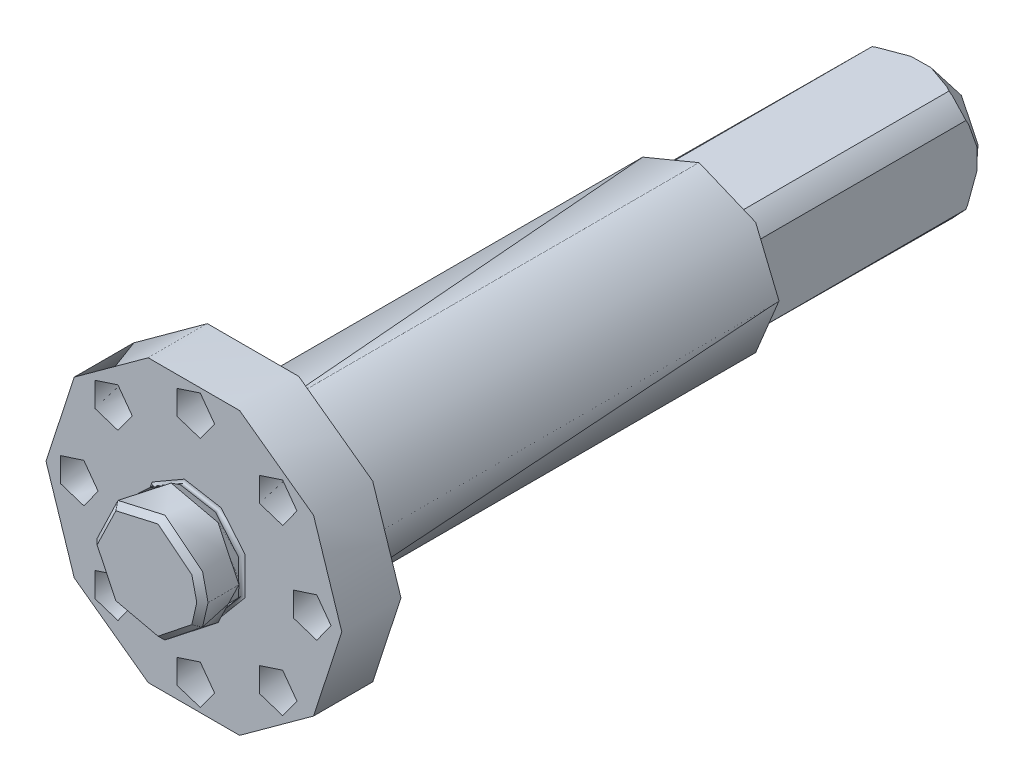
SolidWorks part; units mm, degrees
ref_plane "Front Plane" through (0, 0, 0) normal (0, 0, 1) x (1, 0, 0)
ref_plane "Top Plane" through (0, 0, 0) normal (0, 1, 0) x (1, 0, 0)
ref_plane "Right Plane" through (0, 0, 0) normal (1, 0, 0) x (0, 0, -1)
sketch "Sketch1" plane through (0, 0, 0) normal (1, 0, 0) x (0, 0, -1)
  line L0 (0, 0) -> (-51.9512, 0) construction
  line L1 (0, 0) -> (0, 7.5)
  line L2 (0, 7.5) -> (4.9394, 7.5)
  line L3 (6.35, 7.373) -> (6.35, 20)
  line L4 (6.35, 20) -> (14.35, 20)
  line L5 (14.35, 20) -> (14.35, 10.795)
  line L6 (4.9394, 7.5) -> (5.7547, 7.0293)
  line L7 (14.35, 10.795) -> (74.675, 10.795)
  line L11 (106.425, 9.1281) -> (106.425, 0)
  line L12 (106.425, 0) -> (0, 0)
  line L13 (74.675, 9.1281) -> (106.425, 9.1281)
  line L15 (74.675, 10.795) -> (74.675, 9.1281)
  arc A0 (6.35, 7.373) -> (5.7547, 7.0293) centre (5.9531, 7.373) cw
  dimension "D10" = 0.3969
  dimension "D1" = 18.2562
  dimension "D4" = 60.325
  dimension "D5" = 40
  dimension "D6" = 15
  dimension "D7" = 6.35
  dimension "D8" = 8
  dimension "D11" = 60
  dimension "D12" = 0.127
  dimension "D13" = 21.59
  dimension "D14" = 31.75
revolve "Revolve1" add sketch "Sketch1" angle 360 about L0
hole_wizard "M5 Clearance Hole1" positions "Sketch3" profile "Sketch2" hole size "M5" standard "ANSI Metric"
sketch "Sketch3" plane through (0, 0, -6.35) normal (0, 0, 1) x (1, 0, 0)
  circle A0 centre (0, 0) radius 15.75 construction
  point P0 (-15.75, 0)
  dimension "D1" = 31.5
sketch "Sketch2" plane through (-15.75, 0, -6.35) normal (1, 0, 0) x (0, -1, 0)
  line L0 (0, 0) -> (0, 8.001)
  line L1 (0, 8.001) -> (2.8, 8.001)
  line L2 (2.8, 8.001) -> (2.8, 0)
  line L5 (2.8, 0) -> (0, 0)
  line L11 (0, -6.35) -> (0, 107.95) construction
  dimension "Thru Hole Dia." = 5.6
  dimension "Thru Hole Depth" = 8.001
pattern_circular "CirPattern1" count 8 over 360 about axis through (0, 0, 0) along (0, 0, 1) of "M5 Clearance Hole1"
chamfer "Chamfer1" distance 0.762 angle 45 1 edges at (-7.5, 0, 0)
chamfer "Chamfer2" distance 3.175 angle 45 1 edges at (-9.1281, 0, -106.425)
sketch "Sketch4" plane through (0, 0, -106.425) normal (0, 0, -1) x (-1, 0, 0)
  line L0 (0, -7.5) -> (0, 0) construction
  line L1 (-7.5, 7.5) -> (7.5, 7.5)
  line L2 (-7.5, 7.5) -> (-7.5, -7.5)
  line L3 (-7.5, -7.5) -> (7.5, -7.5)
  line L4 (7.5, 7.5) -> (7.5, -7.5)
  line L5 (7.5, 7.5) -> (-7.5, -7.5) construction
  dimension "D1" = 15
extrude "Cut-Extrude1" cut sketch "Sketch4" against normal offset from surface (31.623 mm away) 0.127 flip side to cut
sketch "Sketch5" plane through (0, 0, 0) normal (1, 0, 0) x (0, 0, -1)
  line L0 (14.35, 10.795) -> (14.35, 10.668)
  line L1 (15.112, 10.2281) -> (16.094, 10.795)
  line L2 (16.094, 10.795) -> (14.35, 10.795)
  line L3 (74.675, 10.795) -> (14.35, 10.795) construction
  line L4 (14.35, -10.795) -> (14.35, 10.795) construction
  line L5 (0, 0) -> (35.4538, 0) construction
  arc A0 (15.112, 10.2281) -> (14.35, 10.668) centre (14.858, 10.668) cw
  dimension "D1" = 0.508
  dimension "D2" = 60
  dimension "D3" = 0.127
revolve "Cut-Revolve1" cut sketch "Sketch5" angle 360 about L5
